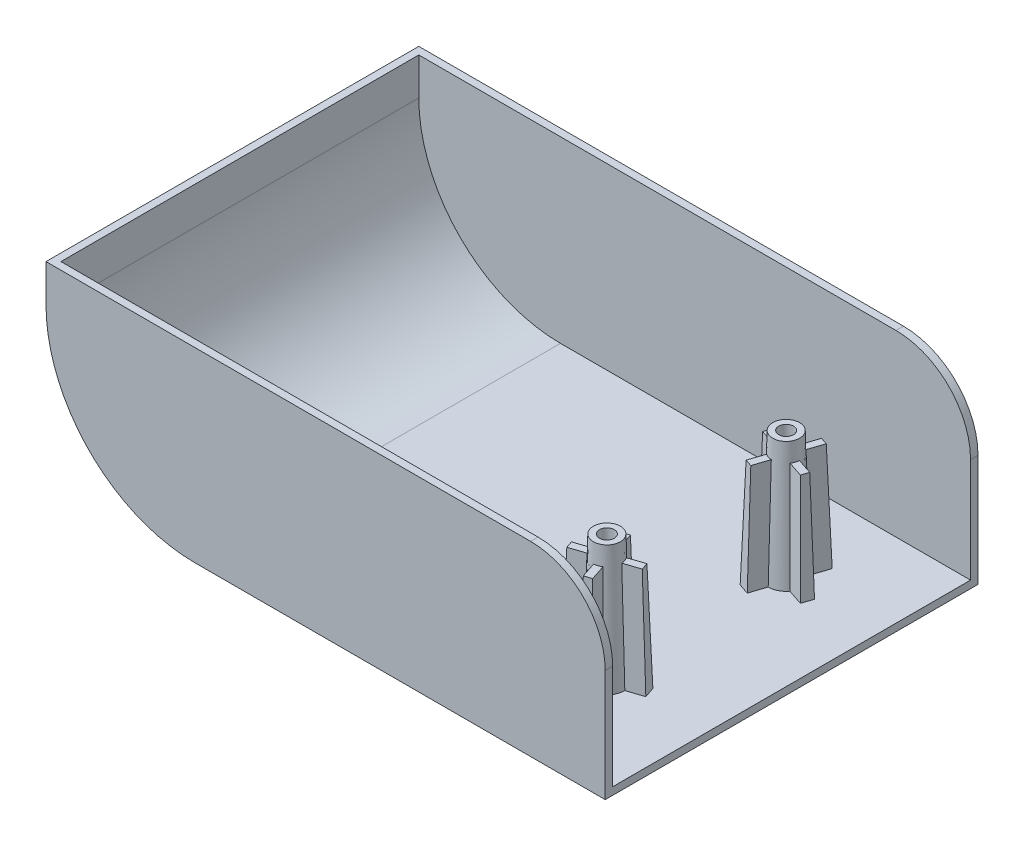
SolidWorks part; units mm, degrees
ref_plane "Front Plane" through (0, 0, 0) normal (0, 0, 1) x (1, 0, 0)
ref_plane "Top Plane" through (0, 0, 0) normal (0, 1, 0) x (1, 0, 0)
ref_plane "Right Plane" through (0, 0, 0) normal (1, 0, 0) x (0, 0, -1)
sketch "Sketch1" plane through (0, 0, 0) normal (0, 0, 1) x (1, 0, 0)
  line L0 (0, 0) -> (0, 57.2412) construction
  line L5 (-75, 20) -> (-75, 25)
  line L6 (0, 25) -> (-75, 25)
  line L7 (0, 0) -> (0, 25)
  line L8 (0, 0) -> (-55, 0)
  arc A1 (-55, 0) -> (-75, 20) centre (-55, 20) cw
extrude "Extrude1" add sketch "Sketch1" along normal mid plane 50
fillet "Fillet1" radius 10 1 edges at (0, 25, 0)
shell "Shell1" thickness 1
sketch3d "3DSketch1"
  point P0 (-12.7517, 1, 12.0249)
other "Mounting Boss1" parameters "BossDiam"=4.8, "BossHeight"=17, "FinHeight"=14.5, "FinLength"=4, "FinWidth"=1.5, "InsDiam"=2, "InsHeight"=5, "BossDraft"=2, "FinDraft"=1, "InsDraft"=1
mirror "Mirror1" about plane through (0, 0, 0) normal (0, 0, 1) of "Mounting Boss1"
